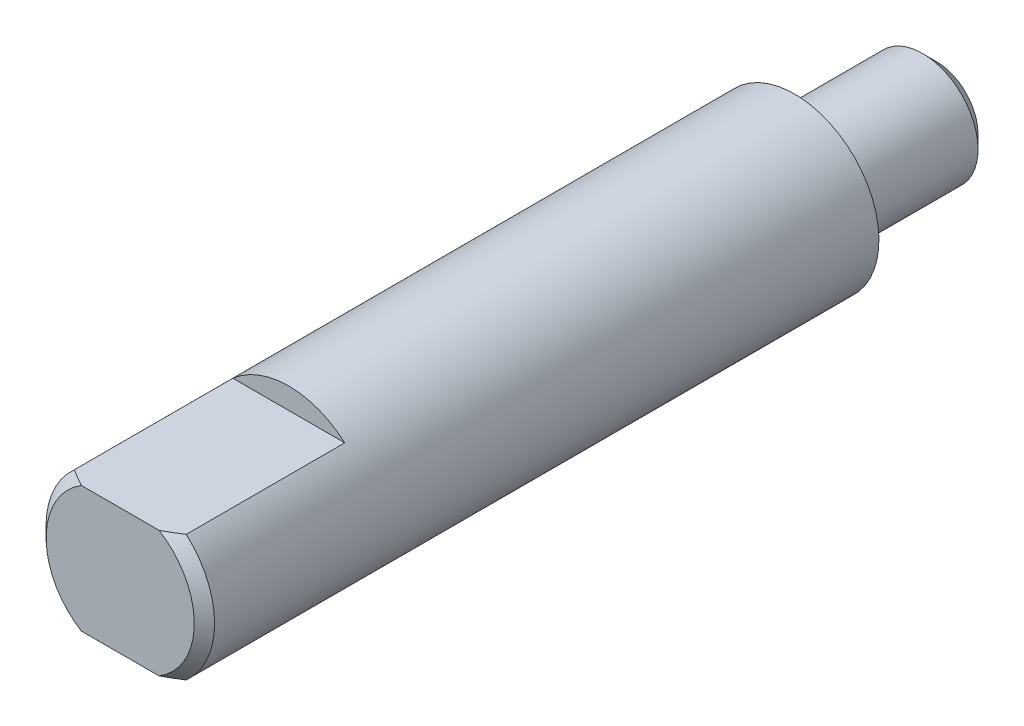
SolidWorks part; units mm, degrees
ref_plane "Front" through (0, 0, 0) normal (0, 0, 1) x (1, 0, 0)
ref_plane "Top" through (0, 0, 0) normal (0, 1, 0) x (1, 0, 0)
ref_plane "Right" through (0, 0, 0) normal (1, 0, 0) x (0, 0, -1)
sketch "Sketch1" plane through (0, 0, 0) normal (1, 0, 0) x (0, 0, -1)
  line L0 (26.67, 1.57) -> (26.16, 2.0828)
  line L1 (-4.064, 0) -> (26.67, 0)
  line L2 (-4.064, 0) -> (-4.064, 2.79)
  line L3 (-3.684, 3.175) -> (21.336, 3.175)
  line L4 (21.336, 2.0828) -> (21.336, 3.175)
  line L5 (153.7208, 0) -> (-49846.2792, 0) construction
  line L6 (-4.064, 2.79) -> (-3.684, 3.175)
  line L7 (21.336, 2.0828) -> (26.16, 2.0828)
  line L8 (26.67, 0) -> (26.67, 1.57)
  point P2 (-6.0706, -0.0337)
  dimension "D1" = 25.4
  dimension "D2" = 3.175
  dimension "D3" = 4.1656
  dimension "D4" = 5.334
  dimension "D5" = 1.57
  dimension "D6" = 0.51
  dimension "D7" = 2.79
  dimension "D8" = 0.38
  dimension "D9" = 4.064
revolve "Revolve1" add sketch "Sketch1" angle 360 about L1
sketch "Sketch2" plane through (0, 0, 0) normal (1, 0, 0) x (0, 0, -1)
  line L0 (-4.064, 2.79) -> (-4.064, -2.79) construction
  line L1 (-4.064, 2.375) -> (2.286, 2.375)
  line L2 (-4.064, 2.375) -> (-4.064, 3.175)
  line L3 (-4.064, 3.175) -> (2.286, 3.175)
  line L4 (2.286, 2.375) -> (2.286, 3.175)
  line L5 (21.336, 3.175) -> (-3.684, 3.175) construction
  line L6 (0, 0) -> (6.0811, 0) construction
  line L7 (2.286, -2.375) -> (2.286, -3.175)
  line L8 (-4.064, -3.175) -> (2.286, -3.175)
  line L9 (-4.064, -2.375) -> (-4.064, -3.175)
  line L10 (-4.064, -2.375) -> (2.286, -2.375)
  dimension "D1" = 0.8
  dimension "D2" = 6.35
extrude "Cut-Extrude1" cut sketch "Sketch2" against normal mid plane 10
